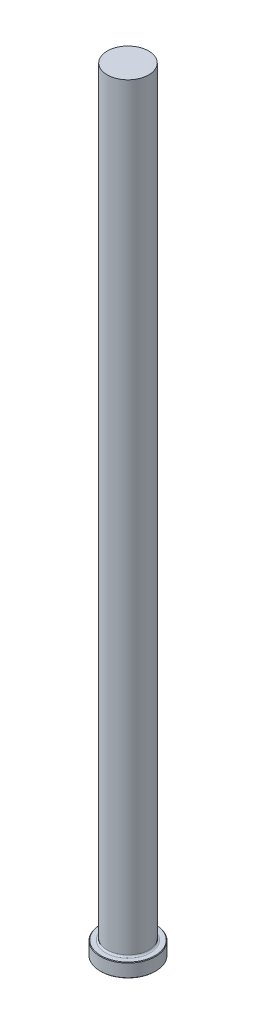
SolidWorks part; units mm, degrees
ref_plane "Front Plane" through (0, 0, 0) normal (0, 0, 1) x (1, 0, 0)
ref_plane "Top Plane" through (0, 0, 0) normal (0, 1, 0) x (1, 0, 0)
ref_plane "Right Plane" through (0, 0, 0) normal (1, 0, 0) x (0, 0, -1)
sketch "Sketch1" plane through (0, 0, 0) normal (0, 0, 1) x (1, 0, 0)
  line L0 (0, 259.9588) -> (0, -15.1925) construction
  line L1 (0, 0) -> (-12.7, 0)
  line L2 (-12.7, 0) -> (-12.7, 6.35)
  line L3 (-12.7, 6.35) -> (-9.525, 6.35)
  line L4 (-9.525, 6.35) -> (-9.525, 355.6)
  line L5 (-9.525, 355.6) -> (0, 355.6)
  line L6 (0, 355.6) -> (0, 0)
  dimension "L" = 355.6
  dimension "H" = 25.4
  dimension "T" = 6.35
  dimension "D" = 19.05
revolve "Revolve1" add sketch "Sketch1" angle 360 about L0
chamfer "Chamfer1" distance 0.254 angle 45 2 edges at (0, 6.35, 12.7) (0, 0, 12.7)
fillet "Fillet1" radius 0.762 1 edges at (0, 6.35, 9.525)
sketch "Pocket Sketch" plane through (0, 0, 0) normal (0, 0, 1) x (1, 0, 0)
  line L0 (-13.0969, 0) -> (-13.0969, 6.3754)
  line L1 (-13.0969, 6.3754) -> (-10.6839, 6.3754)
  line L2 (-9.9219, 7.1374) -> (-9.9219, 22.225)
  line L3 (-9.9219, 22.225) -> (0, 22.225)
  line L4 (0, 22.225) -> (0, 0)
  line L5 (0, 0) -> (-13.0969, 0)
  line L6 (0, 12.6104) -> (0, -2.4989) construction
  line L7 (-12.7, 6.096) -> (-12.7, 0.254) construction
  line L8 (12.446, 6.35) -> (-12.446, 6.35) construction
  line L9 (-9.525, 355.6) -> (-9.525, 7.112) construction
  line L10 (-10.6839, 6.3754) -> (-9.9219, 7.1374)
  point P3 (-9.9219, 6.3754)
  dimension "D1" = 26.1937
  dimension "D2" = 0.3969
  dimension "D3" = 0.0254
  dimension "D4" = 0.3969
  dimension "D5" = 19.8437
  dimension "D6" = 22.225
